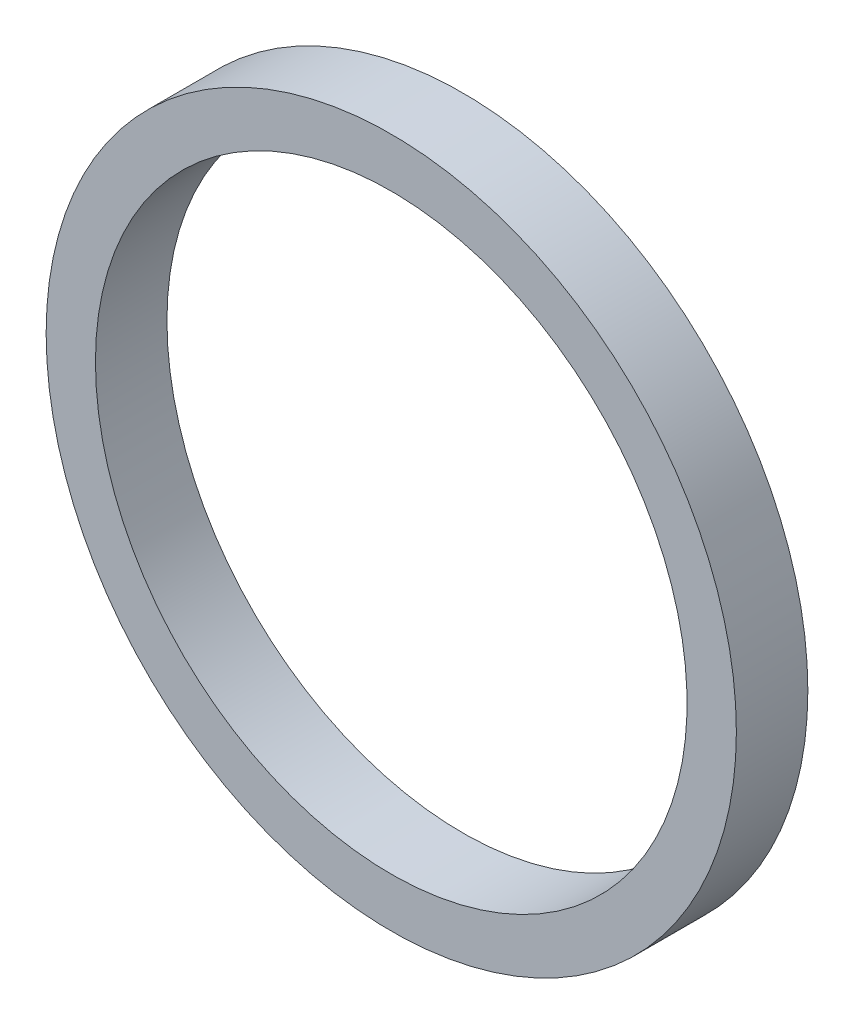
SolidWorks part; units mm, degrees
ref_plane "Спереди" through (0, 0, 0) normal (0, 0, 1) x (1, 0, 0)
ref_plane "Сверху" through (0, 0, 0) normal (0, 1, 0) x (1, 0, 0)
ref_plane "Справа" through (0, 0, 0) normal (1, 0, 0) x (0, 0, -1)
sketch "Sketch1" plane through (0, 0, 0) normal (0, 0, 1) x (1, 0, 0)
  circle A0 centre (0, 0) radius 35
  circle A1 centre (0, 0) radius 30
  dimension "D1" = 60
  dimension "D2" = 5
extrude "Extrude1" add sketch "Sketch1" along normal blind 7.25
